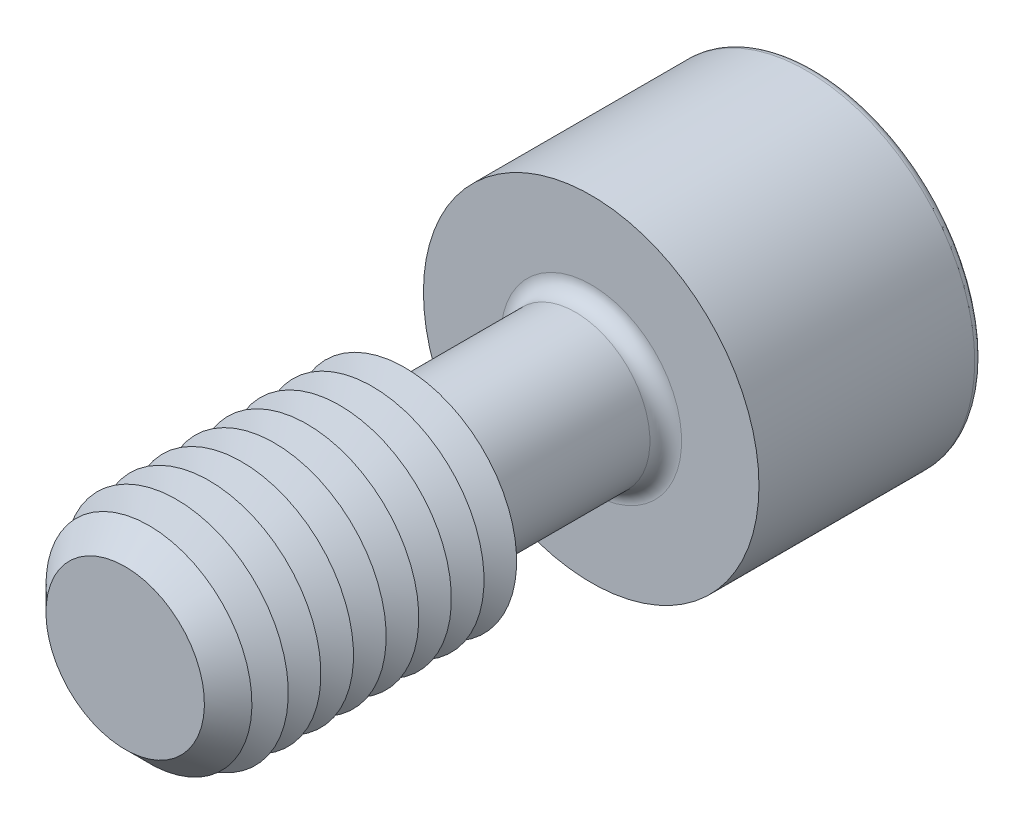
SolidWorks part; units mm, degrees
ref_plane "Front Plane" through (0, 0, 0) normal (0, 0, 1) x (1, 0, 0)
ref_plane "Top Plane" through (0, 0, 0) normal (0, 1, 0) x (1, 0, 0)
ref_plane "Right Plane" through (0, 0, 0) normal (1, 0, 0) x (0, 0, -1)
sketch "Sketch1" plane through (0, 0, 0) normal (0, 0, 1) x (1, 0, 0)
  circle A0 centre (0, 0) radius 4
  dimension "D1" = 8
extrude "Extrude1" add sketch "Sketch1" along normal mid plane 25
sketch "Sketch2" plane through (0, 0, 0) normal (1, 0, 0) x (0, 0, -1)
  line L0 (-12.5, 0) -> (-12.5, 6)
  line L1 (-12.5, 4) -> (-12.5, -4) construction
  line L2 (-12.5, 6) -> (2.5, 6)
  line L3 (2.5, 6) -> (3.6547, 4)
  line L4 (12.5, 4) -> (-12.5, 4) construction
  line L5 (3.6547, 4) -> (3.6547, 0)
  line L6 (3.6547, 0) -> (-12.5, 0)
  dimension "D1" = 6
  dimension "D2" = 120
  dimension "D3" = 15
revolve "Revolve1" add sketch "Sketch2" angle 360 about L6
chamfer "Chamfer1" distance 1.75 angle 45 1 edges at (0, 6, 12.5)
sketch "Sketch3" plane through (0, 0, -12.5) normal (0, 0, -1) x (-1, 0, 0)
  circle A0 centre (0, 0) radius 9
  dimension "D1" = 18
extrude "Extrude2" add sketch "Sketch3" along normal blind 12
sketch "Sketch4" plane through (-13.7, 0, -24.5) normal (0, 0, 1) x (1, 0, 0)
  line L2 (10.8132, -5) -> (16.5868, -5)
  line L3 (16.5868, -5) -> (19.4735, 0)
  line L4 (19.4735, 0) -> (16.5868, 5)
  line L6 (16.5868, 5) -> (10.8132, 5)
  line L7 (10.8132, 5) -> (7.9265, 0)
  line L8 (7.9265, 0) -> (10.8132, -5)
  circle A0 centre (13.7, 0) radius 5 construction
  dimension "D1" = 10
extrude "Extrude3" cut sketch "Sketch4" along normal blind 10
fillet "Fillet1" radius 0.85 1 edges at (-4, 0, -12.5)
fillet "Fillet2" radius 0.425 1 edges at (-9, 0, -24.5)
sketch "Sketch5" plane through (0, 0, 0) normal (1, 0, 0) x (0, 0, -1)
  line L0 (14.5, 0) -> (14.5, -5)
  line L1 (14.5, -5) -> (11.6132, 0)
  line L2 (11.6132, 0) -> (14.5, 0)
  dimension "D1" = 30
revolve "Cut-Revolve1" cut sketch "Sketch5" angle 360 about L2
sketch "Sketch6" plane through (0, 0, 0) normal (1, 0, 0) x (0, 0, -1)
  line L0 (1.332, 0) -> (-13.289, 0) construction
sketch "Sketch7" plane through (0, 0, 0) normal (1, 0, 0) x (0, 0, -1)
  line L0 (2.5, 6) -> (1.625, 4.4845)
  line L1 (1.625, 4.4845) -> (0.75, 6)
  line L2 (2.5, 6) -> (-10.75, 6) construction
  line L3 (0.75, 6) -> (2.5, 6)
  dimension "D1" = 1.75
revolve "Cut-Revolve2" cut sketch "Sketch7" angle 360 about L0
pattern_linear "LPattern1" count 8 spacing 1.75 along (0, 0, 1) of "Cut-Revolve2"
